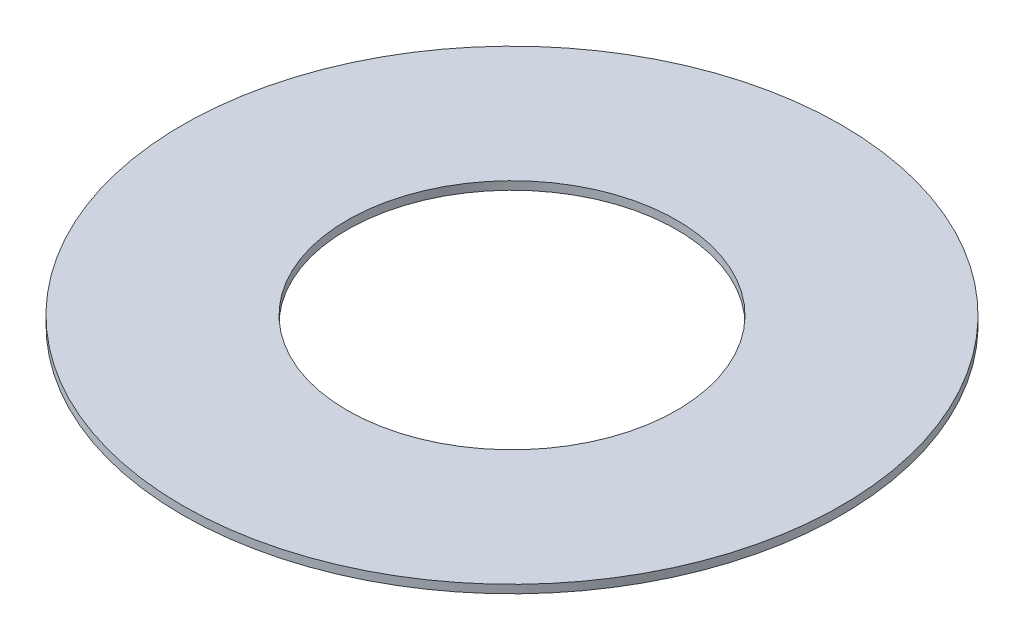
SolidWorks part; units mm, degrees
ref_plane "Front Plane" through (0, 0, 0) normal (0, 0, 1) x (1, 0, 0)
ref_plane "Top Plane" through (0, 0, 0) normal (0, 1, 0) x (1, 0, 0)
ref_plane "Right Plane" through (0, 0, 0) normal (1, 0, 0) x (0, 0, -1)
sketch "Sketch1" plane through (0, 0, 0) normal (0, 1, 0) x (1, 0, 0)
  circle A0 centre (0, 0) radius 101.6
  circle A1 centre (0, 0) radius 50.8
  dimension "D1" = 203.2
  dimension "D2" = 101.6
extrude "Boss-Extrude1" add sketch "Sketch1" along normal blind 2.54
